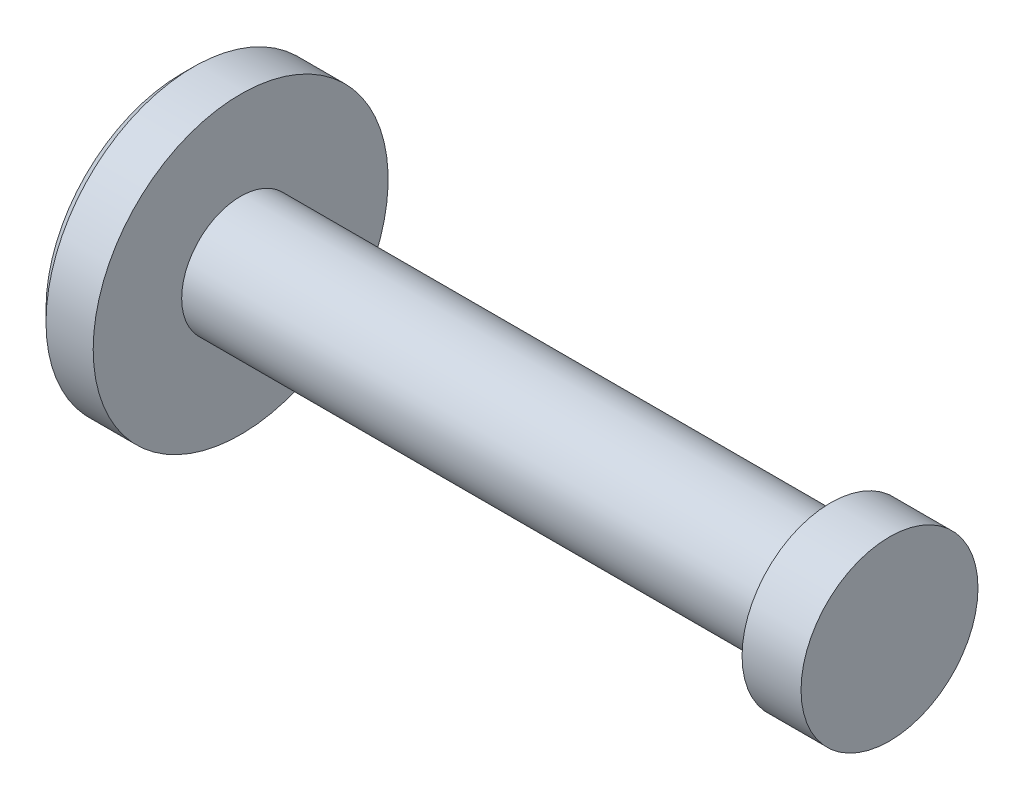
SolidWorks part; units mm, degrees
ref_plane "face" through (0, 0, 0) normal (0, 0, 1) x (1, 0, 0)
ref_plane "dessus" through (0, 0, 0) normal (0, 1, 0) x (1, 0, 0)
ref_plane "droite" through (0, 0, 0) normal (1, 0, 0) x (0, 0, -1)
sketch "Esquisse1" plane through (0, 0, 0) normal (0, 0, 1) x (1, 0, 0)
  line L0 (0, 0) -> (0, -1.5)
  line L1 (0, -1.5) -> (-1, -1.5)
  line L2 (-1, -1.5) -> (-1, -1)
  line L3 (-1, -1) -> (-11, -1)
  line L4 (-11, -1) -> (-11, -2.5)
  line L5 (-11, -2.5) -> (-12, -2.5)
  line L6 (-12, -2.5) -> (-12, 0)
  line L7 (-12, 0) -> (0, 0)
  line L8 (-90, 0) -> (40, 0) construction
  dimension "D1" = 1.5
  dimension "D2" = 1
  dimension "D3" = 1
  dimension "D4" = 10
  dimension "D5" = 2.5
  dimension "D6" = 1
revolve "Base-Révolution" add sketch "Esquisse1" angle 360 about L8
chamfer "Chanfrein2" distance 0.2 angle 45
